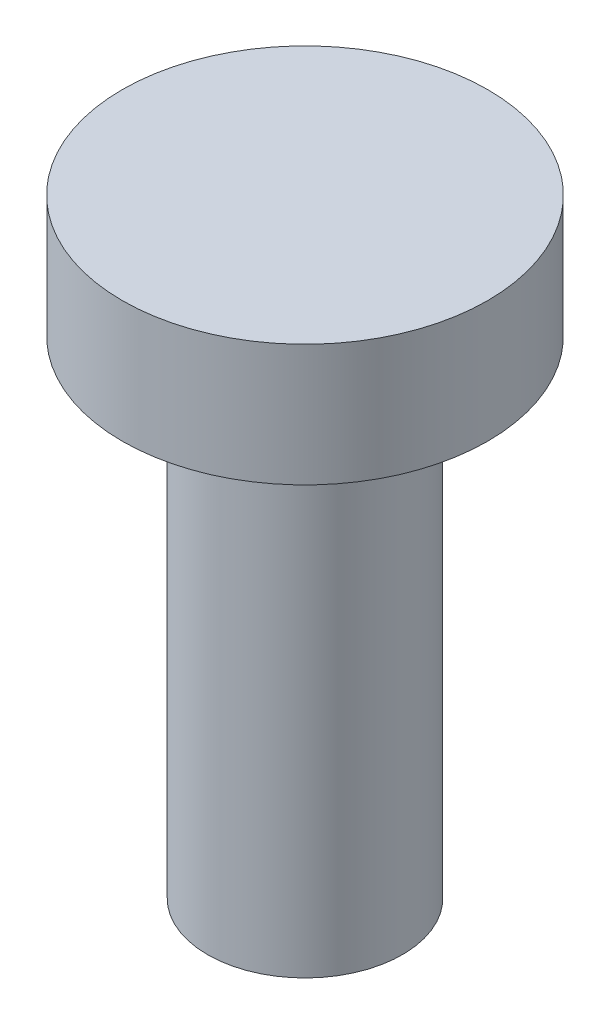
SolidWorks part; units mm, degrees
ref_plane "Front Plane" through (0, 0, 0) normal (0, 0, 1) x (1, 0, 0)
ref_plane "Top Plane" through (0, 0, 0) normal (0, 1, 0) x (1, 0, 0)
ref_plane "Right Plane" through (0, 0, 0) normal (1, 0, 0) x (0, 0, -1)
sketch "Sketch1" plane through (0, 0, 0) normal (0, 1, 0) x (1, 0, 0)
  circle A0 centre (0, 0) radius 5.08
  dimension "D1" = 10.16
extrude "Extrude1" add sketch "Sketch1" along normal blind 25.4
sketch "Sketch2" plane through (0, 25.4, 0) normal (0, 1, 0) x (-1, 0, 0)
  circle A0 centre (0, 0) radius 9.525
  dimension "D1" = 19.05
extrude "Extrude2" add sketch "Sketch2" along normal blind 6.35
sketch "Sketch6" plane through (0, 0, 0) normal (0, -1, 0) x (1, 0, 0)
  circle A0 centre (0, 0) radius 2.286
  dimension "D1" = 4.572
extrude "Cut-Extrude1" cut sketch "Sketch6" against normal blind 6.35
